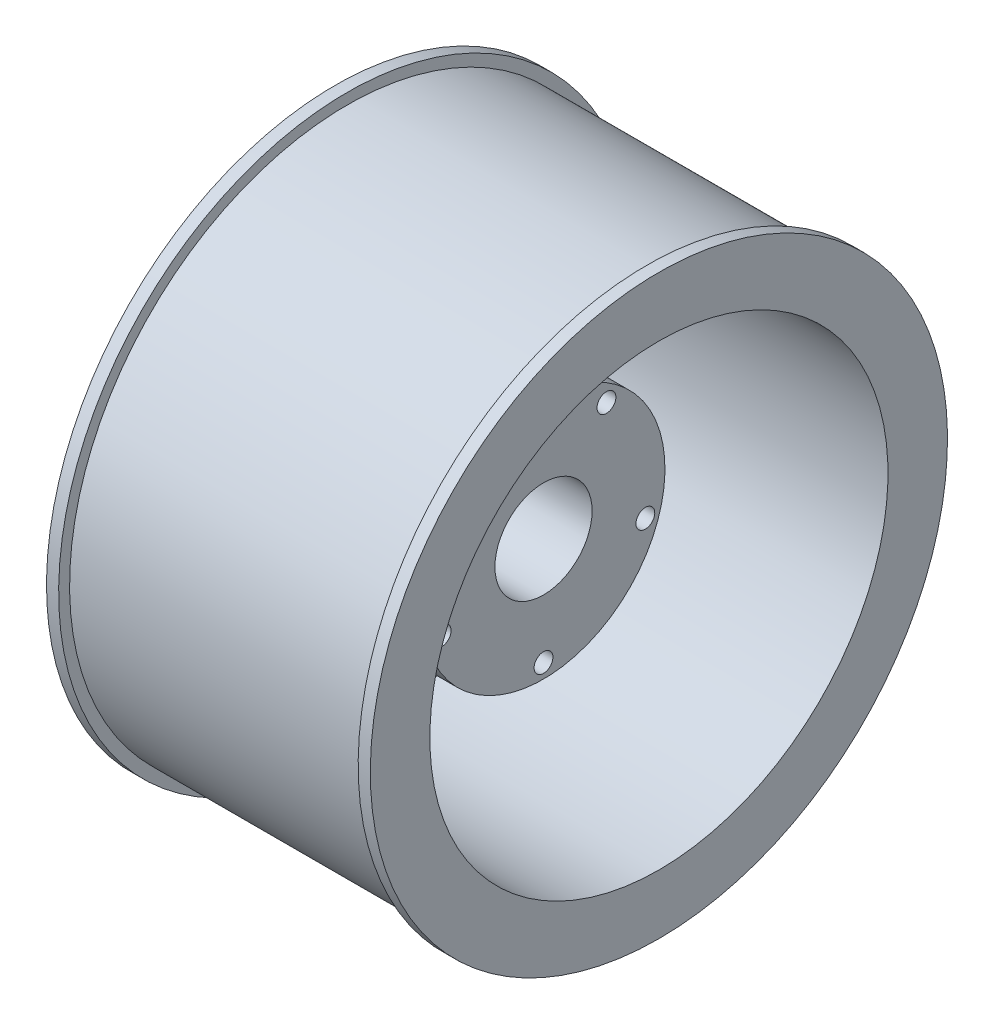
SolidWorks part; units mm, degrees
ref_plane "Front Plane" through (0, 0, 0) normal (0, 0, 1) x (1, 0, 0)
ref_plane "Top Plane" through (0, 0, 0) normal (0, 1, 0) x (1, 0, 0)
ref_plane "Right Plane" through (0, 0, 0) normal (1, 0, 0) x (0, 0, -1)
sketch "Sketch4" plane through (0, 0, 0) normal (0, 0, 1) x (1, 0, 0)
  line L0 (-10, 237.6) -> (-10, 213.6)
  line L1 (-10, 213.6) -> (0, 213.6)
  line L2 (0, 213.6) -> (57.2339, 0)
  line L3 (246.6, 228.6) -> (0, 228.6)
  line L4 (-10, 237.6) -> (0, 237.6)
  line L5 (0, 0) -> (0, 213.6) construction
  line L6 (123.3, 228.6) -> (123.3, 200.8715) construction
  line L7 (0, 228.6) -> (0, 237.6)
  line L8 (246.6, 228.6) -> (246.6, 237.6)
  line L9 (256.6, 237.6) -> (246.6, 237.6)
  line L10 (25, 213.6) -> (256.6, 213.6)
  line L11 (256.6, 237.6) -> (256.6, 213.6)
  line L12 (57.2339, 0) -> (82.2339, 0)
  line L13 (82.2339, 0) -> (25, 213.6)
  dimension "D1" = 246.6
  dimension "D2" = 24
  dimension "D3" = 10
  dimension "D4" = 15
  dimension "D5" = 25
  dimension "D6" = 57.2339
  dimension "D7" = 228.6
revolve "Revolve1" add sketch "Sketch4" angle 360 about L12
ref_plane "Plane1" through (161.6, 0, 0) normal (1, 0, 0) x (0, 0, -1)
sketch "Sketch5" plane through (161.6, 0, 0) normal (1, 0, 0) x (0, 0, -1)
  circle A0 centre (0, 0) radius 100
  dimension "D1" = 200
extrude "Extrude1" add sketch "Sketch5" against normal blind 140
sketch "Sketch7" plane through (21.6, 0, 0) normal (-1, 0, 0) x (0, 0, 1)
  circle A1 centre (0, 0) radius 100
  circle A2 centre (0, 0) radius 100
  dimension "D1" = 0
extrude "Cut-Extrude1" cut sketch "Sketch7" against normal blind 0.75
ref_plane "Plane2" through (0, 0, 0) normal (0, 0, 1) x (1, 0, 0)
sketch "Sketch8" plane through (0, 0, 0) normal (0, 0, 1) x (1, 0, 0)
  line L0 (30.439, 100) -> (22.35, 91.911)
  line L1 (30.439, -100) -> (30.439, 100) construction
  line L2 (22.35, 100) -> (22.35, -100) construction
  line L3 (22.35, 91.911) -> (15.0036, 95.2692)
  line L4 (15.0036, 95.2692) -> (23.1898, 106.1468)
  line L5 (23.1898, 106.1468) -> (30.439, 100)
sketch "Sketch9" plane through (22.35, 0, 0) normal (-1, 0, 0) x (0, 0, 1)
  circle A1 centre (0, 0) radius 100
  circle A2 centre (0, 0) radius 100
  dimension "D1" = 0
sweep "Cut-Sweep1" cut profiles "Sketch8" path "Sketch9"
sketch "Sketch10" plane through (-10, 0, 0) normal (-1, 0, 0) x (0, 0, 1)
  line L0 (0, 213.6) -> (0, 100) construction
  circle A0 centre (0, 0) radius 213.6 construction
  circle A1 centre (0, 0) radius 213.6 construction
  circle A2 centre (0, 0) radius 100 construction
  arc A3 (54.3624, 206.5664) -> (-54.3624, 206.5664) centre (0, 0) ccw
  spline S0 degree 3 poles (-54.3624, 206.5664) (-53.8489, 194.0734) (-52.1294, 152.2422) (-21.4893, 121.5358) (0, 100) knots 0 0 0 0 0.298652 1 1 1 1
  spline S1 degree 3 poles (54.3624, 206.5664) (53.8489, 194.0734) (52.1294, 152.2422) (21.4893, 121.5358) (0, 100) knots 0 0 0 0 0.298652 1 1 1 1
extrude "Cut-Extrude2" cut sketch "Sketch10" against normal through all
sketch "Sketch17" plane through (22.35, 0, 0) normal (-1, 0, 0) x (0, 0, 1)
  circle A0 centre (0, 0) radius 40
  dimension "D1" = 80
extrude "Cut-Extrude3" cut sketch "Sketch17" against normal through all
pattern_circular "CirPattern1" count 5 over 360 about axis through (22.35, 0, 0) along (1, 0, 0) of "Cut-Extrude2"
sketch "Sketch18" plane through (22.35, 0, 0) normal (-1, 0, 0) x (0, 0, 1)
  line L0 (0, -213.6) -> (0, -88.1501) construction
  arc A0 (-77.4365, -199.0692) -> (77.4365, -199.0692) centre (0, 0) ccw construction
hole_wizard "CBORE for M14 Hex Head Bolt1" positions "3DSketch1" profile "Sketch19" counterbore size "M14" standard "Ansi Metric"
sketch3d "3DSketch1"
  point P0 (22.35, -88.1501, 0)
sketch "Sketch19" plane through (22.35, -88.1501, 0) normal (0, 1, 0) x (0, 0, 1)
  line L0 (0, 0) -> (0, 234.25)
  line L1 (0, 234.25) -> (7.75, 234.25)
  line L3 (7.75, 234.25) -> (7.75, 9.25)
  line L4 (7.75, 9.25) -> (13.625, 9.25)
  line L5 (13.625, 9.25) -> (13.625, 0)
  line L7 (13.625, 0) -> (0, 0)
  line L11 (0, -6.35) -> (0, 107.95) construction
  dimension "Thru Hole Dia." = 15.5
  dimension "Thru Hole Depth" = 234.25
  dimension "C'Bore Dia." = 27.25
  dimension "C'Bore Depth" = 9.25
pattern_circular "CirPattern2" count 5 over 360 about axis through (0, 0, 0) along (1, 0, 0) of "CBORE for M14 Hex Head Bolt1"
sketch "Sketch20" plane through (22.35, 0, 0) normal (-1, 0, 0) x (0, 0, 1)
  circle A0 centre (0, 0) radius 60.7901
extrude "Cut-Extrude4" cut sketch "Sketch20" against normal blind 15
chamfer "Chamfer1" distance 10 distance2 15 1 edges at (22.35, -60.7901, 0)
sketch "Sketch21" plane through (-10, 0, 0) normal (-1, 0, 0) x (0, 0, 1)
  arc A2 (-47.9998, 182.3896) -> (-158.6301, 102.012) centre (0, 0) ccw
  arc A3 (-76.374, 172.4441) -> (-140.4032, 125.9241) centre (0, 0) ccw
  circle A5 centre (-51.8133, 71.3149) radius 38.625
  arc A6 (-42.993, 108.9194) -> (-90.3029, 74.5467) centre (-51.8133, 71.3149) ccw
  spline S5 degree 3 poles (-2660.1495, -1312.2689) (226.9313, -39.215) (101.3521, -40.7434) (-33.2833, 98.194) (-37.2087, 102.3623) (-44.8994, 111.0493) (-48.6657, 115.5682) (-55.8446, 125.0867) (-59.2585, 130.0878) (-63.9278, 138.0507) (-65.4085, 140.7818) (-68.1796, 146.4091) (-69.4701, 149.3054) (-71.8181, 155.2678) (-72.8755, 158.3339) (-74.0241, 162.2693) (-74.2455, 163.0628) (-74.6687, 164.6539) (-74.8695, 165.4472) (-75.4417, 167.8192) (-75.7828, 169.3902) (-76.7029, 174.0667) (-77.1787, 177.1351) (-77.9401, 183.1562) (-78.2256, 186.1092) (-78.6786, 191.8893) (-78.846, 194.7167) (-85.7669, 332.2454) (-24.3095, 303.9244) (-2904.8227, -795.6122) knots -4.0428 -4.0428 -4.0428 -4.0428 0.125 0.125 0.25 0.25 0.375 0.375 0.5 0.5 0.5625 0.5625 0.625 0.625 0.6875 0.6875 0.703125 0.703125 0.71875 0.71875 0.75 0.75 0.8125 0.8125 0.875 0.875 0.9375 0.9375 3.990523 3.990523 3.990523 3.990523 only from (-17.6968, 82.3414) to (-79.3414, 205.5396)
  spline S6 degree 3 poles (-42.993, 108.9194) (-46.1651, 112.5808) (-49.2712, 116.3711) (-55.8446, 125.0867) (-59.2585, 130.0878) (-63.9278, 138.0507) (-65.4085, 140.7818) (-68.1796, 146.4091) (-69.4701, 149.3054) (-71.8181, 155.2678) (-72.8755, 158.3339) (-74.0241, 162.2693) (-74.2455, 163.0628) (-74.6687, 164.6539) (-74.8695, 165.4472) (-75.4417, 167.8192) (-75.7828, 169.3902) (-76.1878, 171.4487) (-76.2826, 171.947) (-76.374, 172.4441) knots 0.271088 0.271088 0.271088 0.271088 0.375 0.375 0.5 0.5 0.5625 0.5625 0.625 0.625 0.6875 0.6875 0.703125 0.703125 0.71875 0.71875 0.75 0.75 0.760016 0.760016 0.760016 0.760016
  spline S8 degree 3 poles (1654.3238, 2516.8077) (-281.5372, 117.0373) (-289.4809, 184.2388) (-160.8219, 135.1577) (-158.1846, 134.1248) (-152.8273, 131.9079) (-150.1071, 130.7238) (-144.6159, 128.1391) (-141.8447, 126.7383) (-137.6815, 124.4182) (-136.2928, 123.6083) (-134.2137, 122.3311) (-133.5213, 121.895) (-132.1389, 121.0008) (-131.4526, 120.545) (-128.0647, 118.2366) (-125.4754, 116.2835) (-120.5305, 112.2079) (-118.1747, 110.0856) (-113.6791, 105.7111) (-111.5393, 103.459) (-105.409, 96.5575) (-101.7076, 91.7653) (-94.8733, 81.9963) (-91.7394, 77.018) (-85.8543, 67.0192) (-83.1029, 61.9979) (7.4296, -108.9817) (-32.8298, -227.9422) (2070.0642, 2124.4289) knots -2.990529 -2.990529 -2.990529 -2.990529 0.0625 0.0625 0.125 0.125 0.1875 0.1875 0.25 0.25 0.28125 0.28125 0.296875 0.296875 0.3125 0.3125 0.375 0.375 0.4375 0.4375 0.5 0.5 0.625 0.625 0.75 0.75 0.875 0.875 5.042794 5.042794 5.042794 5.042794 only from (-170.962, 138.9734) to (-72.8428, 42.2755)
  spline S9 degree 3 poles (-140.4032, 125.9241) (-139.9588, 125.6836) (-139.5141, 125.4395) (-137.6815, 124.4182) (-136.2928, 123.6083) (-134.2137, 122.3311) (-133.5213, 121.895) (-132.1389, 121.0008) (-131.4526, 120.545) (-128.0647, 118.2366) (-125.4754, 116.2835) (-120.5305, 112.2079) (-118.1747, 110.0856) (-113.6791, 105.7111) (-111.5393, 103.459) (-105.409, 96.5575) (-101.7076, 91.7653) (-95.4498, 82.8203) (-92.8049, 78.695) (-90.3029, 74.5467) knots 0.239984 0.239984 0.239984 0.239984 0.25 0.25 0.28125 0.28125 0.296875 0.296875 0.3125 0.3125 0.375 0.375 0.4375 0.4375 0.5 0.5 0.625 0.625 0.728912 0.728912 0.728912 0.728912
  dimension "D1" = 25
  dimension "D2" = 25
  dimension "D3" = 25
  dimension "D4" = 25
extrude "Cut-Extrude5" cut sketch "Sketch21" against normal through all
pattern_circular "CirPattern3" count 5 over 360 about axis through (256.6, 0, 0) along (-1, 0, 0) of "Cut-Extrude5"
fillet "Fillet1" radius 12.5 5 edges at (42.939, -80.9017, -58.7785) (42.939, -80.9017, 58.7785) (42.939, 30.9017, 95.1057) (42.939, 100, 0) (42.939, 30.9017, -95.1057)
sketch "Sketch22" plane through (256.6, 0, 0) normal (1, 0, 0) x (0, 0, -1)
  circle A0 centre (0, 0) radius 213.6 construction
  circle A1 centre (0, 0) radius 213.6
  circle A2 centre (0, 0) radius 188.6
extrude "Extrude2" add sketch "Sketch22" against normal up to surface (231.6 mm away)
